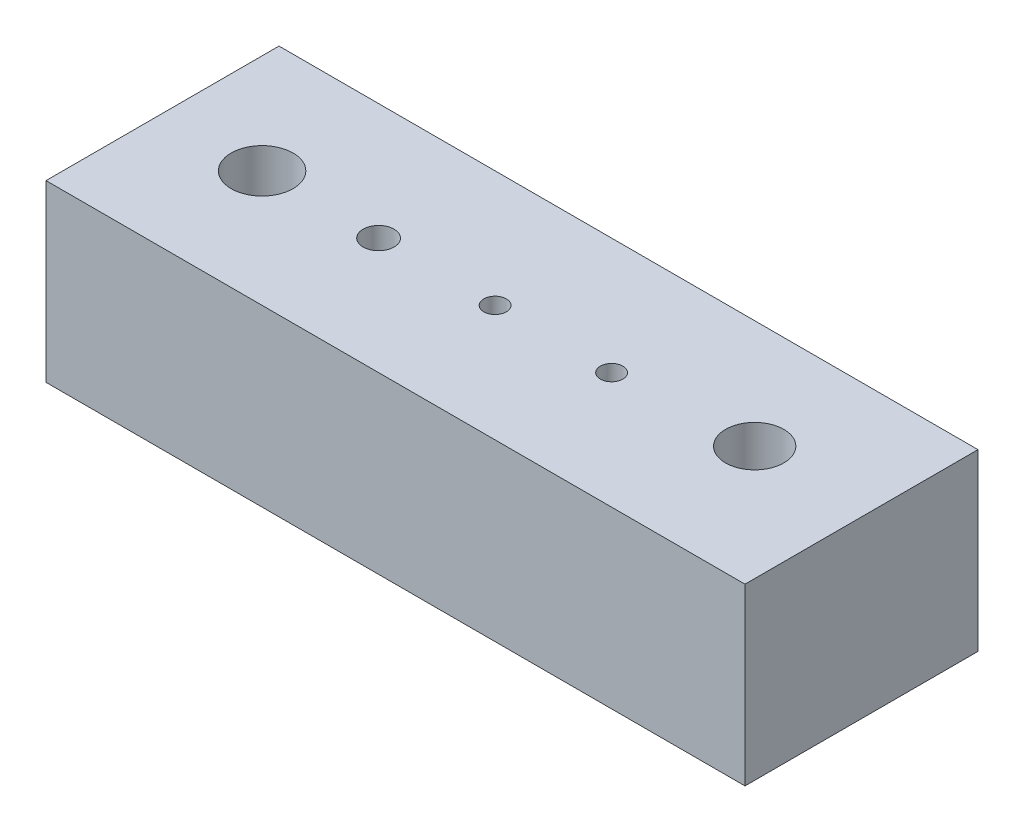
SolidWorks part; units mm, degrees
ref_plane "Front Plane" through (0, 0, 0) normal (0, 0, 1) x (1, 0, 0)
ref_plane "Top Plane" through (0, 0, 0) normal (0, 1, 0) x (1, 0, 0)
ref_plane "Right Plane" through (0, 0, 0) normal (1, 0, 0) x (0, 0, -1)
sketch "Sketch1" plane through (0, 0, 0) normal (0, 1, 0) x (1, 0, 0)
  line L1 (0, 0) -> (152.4, 0)
  line L2 (0, 0) -> (0, 50.8)
  line L3 (0, 50.8) -> (152.4, 50.8)
  line L4 (152.4, 0) -> (152.4, 50.8)
  dimension "D1" = 152.4
  dimension "D2" = 50.8
extrude "Boss-Extrude1" add sketch "Sketch1" along normal blind 38.1
hole_wizard "1/2 Clearance Hole2" positions "Sketch6" profile "Sketch5" hole size "1/2" standard "ANSI Inch"
sketch "Sketch6" plane through (0, 38.1, 0) normal (0, 1, 0) x (1, 0, 0)
  line L0 (0, 50.8) -> (0, 0) construction
  line L1 (152.4, 50.8) -> (0, 50.8) construction
  point P0 (21.717, 25.4)
  point P1 (0, 25.4)
  dimension "D1" = 21.717
  dimension "D2" = 25.4
sketch "Sketch5" plane through (21.717, 38.1, -25.4) normal (1, 0, 0) x (0, 0, 1)
  line L0 (0, 0) -> (0, 38.1)
  line L1 (0, 38.1) -> (6.7462, 38.1)
  line L2 (6.7462, 38.1) -> (6.7462, 0)
  line L5 (6.7462, 0) -> (0, 0)
  line L11 (0, -6.35) -> (0, 107.95) construction
  dimension "Thru Hole Dia." = 13.4925
  dimension "Thru Hole Depth" = 38.1
hole_wizard "1/4 Clearance Hole1" positions "Sketch15" profile "Sketch14" hole size "1/4" standard "ANSI Inch"
sketch "Sketch15" plane through (0, 38.1, 0) normal (0, 1, 0) x (1, 0, 0)
  line L0 (152.4, 50.8) -> (0, 50.8) construction
  circle A0 centre (21.717, 25.4) radius 6.7462 construction
  point P0 (47.117, 25.4)
  dimension "D1" = 25.4
  dimension "D2" = 25.4
sketch "Sketch14" plane through (47.117, 38.1, -25.4) normal (1, 0, 0) x (0, 0, 1)
  line L0 (0, 0) -> (0, 40.1298)
  line L1 (0, 40.1298) -> (3.3782, 38.1)
  line L2 (3.3782, 38.1) -> (3.3782, 0)
  line L5 (3.3782, 0) -> (0, 0)
  line L10 (0, 40.1298) -> (-3.3782, 38.1) construction
  line L11 (0, -6.35) -> (0, 107.95) construction
  dimension "Hole Dia." = 6.7564
  dimension "Hole Depth" = 38.1
  dimension "Drill Angle" = 118
hole_wizard "#10 (0.1935) Diameter Hole1" positions "Sketch13" profile "Sketch12" hole size "#10" standard "ANSI Inch"
sketch "Sketch13" plane through (0, 38.1, 0) normal (0, 1, 0) x (1, 0, 0)
  line L0 (152.4, 50.8) -> (0, 50.8) construction
  circle A0 centre (47.117, 25.4) radius 3.3782 construction
  point P0 (72.517, 25.4)
  dimension "D1" = 25.4
  dimension "D2" = 25.4
sketch "Sketch12" plane through (72.517, 38.1, -25.4) normal (1, 0, 0) x (0, 0, 1)
  line L0 (0, 0) -> (0, 39.5766)
  line L1 (0, 39.5766) -> (2.4574, 38.1)
  line L2 (2.4574, 38.1) -> (2.4574, 0)
  line L5 (2.4574, 0) -> (0, 0)
  line L10 (0, 39.5766) -> (-2.4575, 38.1) construction
  line L11 (0, -6.35) -> (0, 107.95) construction
  dimension "Hole Dia." = 4.9149
  dimension "Hole Depth" = 38.1
  dimension "Drill Angle" = 118
hole_wizard "#10 (0.1935) Diameter Hole2" positions "Sketch9" profile "Sketch7" hole size "#10" standard "ANSI Inch"
sketch "Sketch9" plane through (0, 38.1, 0) normal (0, 1, 0) x (1, 0, 0)
  line L0 (152.4, 50.8) -> (0, 50.8) construction
  circle A0 centre (72.517, 25.4) radius 2.4574 construction
  point P0 (97.917, 25.4)
  point P9 (97.917, 26.07)
  dimension "D1" = 25.4
  dimension "D2" = 25.4
sketch "Sketch7" plane through (97.917, 38.1, -25.4) normal (1, 0, 0) x (0, 0, 1)
  line L0 (0, 0) -> (0, 39.5766)
  line L1 (0, 39.5766) -> (2.4574, 38.1)
  line L2 (2.4574, 38.1) -> (2.4574, 0)
  line L5 (2.4574, 0) -> (0, 0)
  line L10 (0, 39.5766) -> (-2.4575, 38.1) construction
  line L11 (0, -6.35) -> (0, 107.95) construction
  dimension "Hole Dia." = 4.9149
  dimension "Hole Depth" = 38.1
  dimension "Drill Angle" = 118
hole_wizard "1/2 (0.5) Diameter Hole1" positions "Sketch11" profile "Sketch10" hole size "1/2" standard "ANSI Inch"
sketch "Sketch11" plane through (0, 38.1, 0) normal (0, 1, 0) x (1, 0, 0)
  point P0 (127.3999, 27.1142)
sketch "Sketch10" plane through (127.3999, 38.1, -27.1142) normal (1, 0, 0) x (0, 0, 1)
  line L0 (0, 0) -> (0, 41.9155)
  line L1 (0, 41.9155) -> (6.35, 38.1)
  line L2 (6.35, 38.1) -> (6.35, 0)
  line L5 (6.35, 0) -> (0, 0)
  line L10 (0, 41.9155) -> (-6.35, 38.1) construction
  line L11 (0, -6.35) -> (0, 107.95) construction
  dimension "Hole Dia." = 12.7
  dimension "Hole Depth" = 38.1
  dimension "Drill Angle" = 118
